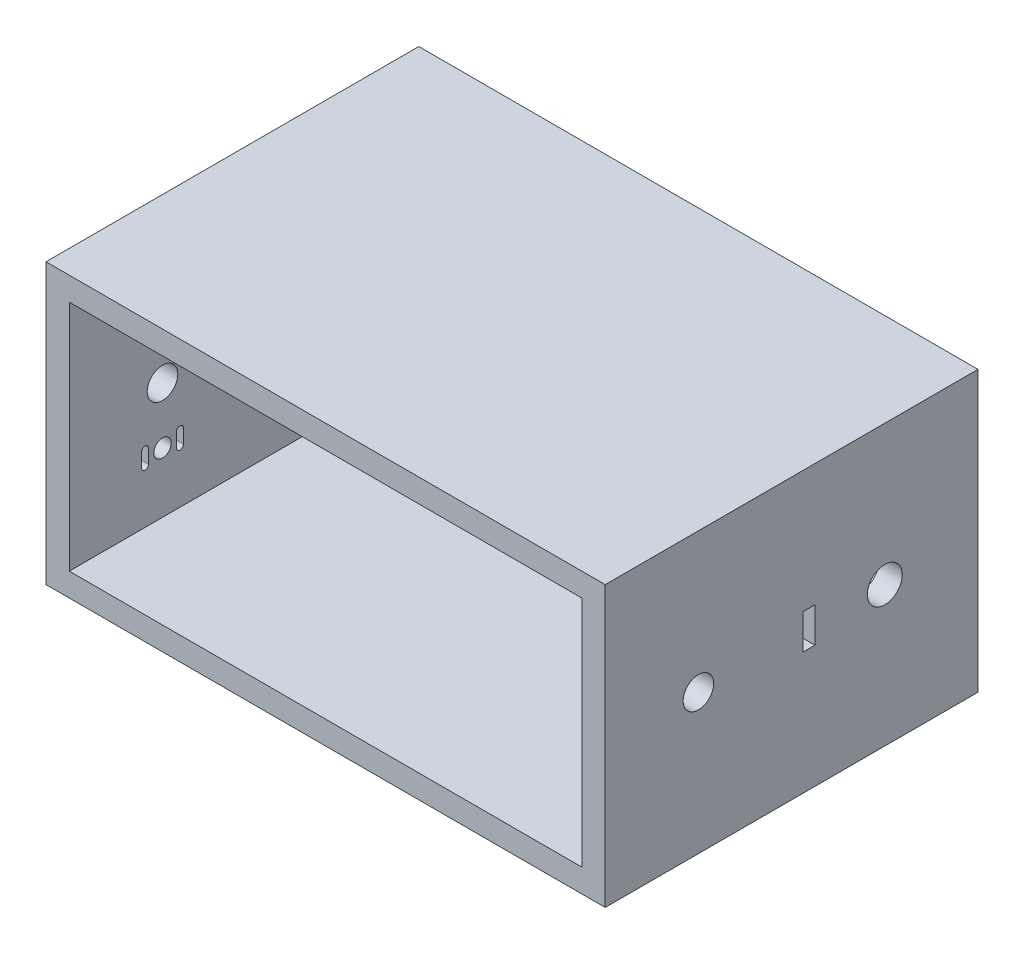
SolidWorks part; units mm, degrees
ref_plane "Front Plane" through (0, 0, 0) normal (0, 0, 1) x (1, 0, 0)
ref_plane "Top Plane" through (0, 0, 0) normal (0, 1, 0) x (1, 0, 0)
ref_plane "Right Plane" through (0, 0, 0) normal (1, 0, 0) x (0, 0, -1)
sketch "Sketch1" plane through (0, 0, 0) normal (0, 0, 1) x (1, 0, 0)
  line L1 (-36.7081, 125.987) -> (268.0919, 125.987)
  line L2 (-36.7081, 125.987) -> (-36.7081, -26.413)
  line L3 (-36.7081, -26.413) -> (268.0919, -26.413)
  line L4 (268.0919, 125.987) -> (268.0919, -26.413)
  line L5 (-24.0081, 113.287) -> (255.3919, 113.287)
  line L6 (-24.0081, 113.287) -> (-24.0081, -13.713)
  line L7 (-24.0081, -13.713) -> (255.3919, -13.713)
  line L8 (255.3919, 113.287) -> (255.3919, -13.713)
  dimension "D1" = 152.4
  dimension "D2" = 304.8
  dimension "D3" = 12.7
  dimension "D4" = 12.7
  dimension "D5" = 12.7
  dimension "D6" = 12.7
extrude "Boss-Extrude1" add sketch "Sketch1" along normal blind 203.2
hole_wizard "3/4-10 Tapped Hole1" positions "Sketch8" profile "Sketch10" tap size "3/4-10" standard "Ansi Inch"
sketch "Sketch8" plane through (268.0919, 0, 0) normal (1, 0, 0) x (0, 0, -1)
  line L1 (-203.2, 125.987) -> (0, 125.987) construction
  line L2 (-203.2, 125.987) -> (-203.2, -26.413) construction
  point P0 (-152.4, 49.787)
  dimension "D1" = 50.8
  dimension "D2" = 76.2
sketch "Sketch10" plane through (268.0919, 49.787, 152.4) normal (0, 1, 0) x (0, 0, -1)
  line L0 (0, 0) -> (0, 304.8)
  line L1 (0, 304.8) -> (8.3337, 304.8)
  line L2 (8.3337, 304.8) -> (8.3337, 0)
  line L5 (8.3337, 0) -> (0, 0)
  line L11 (0, -6.35) -> (0, 107.95) construction
  dimension "Thru Tap Drill Dia." = 16.6675
  dimension "Thru Tap Drill Depth" = 304.8
sketch "Sketch11" plane through (-36.7081, 0, 0) normal (-1, 0, 0) x (0, 0, 1)
  line L0 (161.925, 22.86) -> (161.925, 15.24) construction
  line L1 (203.2, 125.987) -> (203.2, -26.413) construction
  line L2 (142.875, 22.86) -> (142.875, 15.24) construction
  line L3 (144.78, 22.86) -> (144.78, 15.24)
  line L4 (140.97, 22.86) -> (140.97, 15.24)
  line L5 (152.4, 19.05) -> (152.4, 120.7899) construction
  line L6 (160.02, 22.86) -> (160.02, 15.24)
  line L7 (163.83, 22.86) -> (163.83, 15.24)
  circle A0 centre (152.4, 19.05) radius 4.7625
  arc A2 (144.78, 22.86) -> (140.97, 22.86) centre (142.875, 22.86) ccw
  arc A3 (140.97, 15.24) -> (144.78, 15.24) centre (142.875, 15.24) ccw
  arc A4 (160.02, 22.86) -> (163.83, 22.86) centre (161.925, 22.86) cw
  arc A5 (163.83, 15.24) -> (160.02, 15.24) centre (161.925, 15.24) cw
  point P8 (142.875, 19.05)
  point P13 (161.925, 19.05)
  dimension "D1" = 9.525
  dimension "D3" = 9.525
  dimension "D2" = 50.8
extrude "Cut-Extrude1" cut sketch "Sketch11" against normal up to next
sketch "Sketch15" plane through (-36.7081, 0, 0) normal (-1, 0, 0) x (0, 0, 1)
  line L0 (203.2, 125.987) -> (203.2, -26.413) construction
  line L1 (88.9, 40.262) -> (95.25, 40.262)
  line L2 (88.9, 40.262) -> (88.9, 59.312)
  line L3 (88.9, 59.312) -> (95.25, 59.312)
  line L4 (95.25, 40.262) -> (95.25, 59.312)
  line L5 (203.2, 125.987) -> (0, 125.987) construction
  dimension "D1" = 6.35
  dimension "D2" = 19.05
  dimension "D3" = 107.95
  dimension "D4" = 66.675
extrude "Cut-Extrude2" cut sketch "Sketch15" against normal through all
hole_wizard "#97 (0.0059) Diameter Hole3" positions "Sketch17" profile "Sketch16" hole size "#97" standard "Ansi Inch"
sketch "Sketch17" plane through (-36.7081, 0, 0) normal (-1, 0, 0) x (0, 0, 1)
  line L0 (203.2, 125.987) -> (0, 125.987) construction
  line L1 (88.9, 59.312) -> (88.9, 40.262) construction
  point P0 (50.8, 49.787)
  dimension "D1" = 76.2
  dimension "D2" = 38.1
sketch "Sketch16" plane through (-36.7081, 49.787, 50.8) normal (0, 1, 0) x (0, 0, 1)
  line L0 (0, 0) -> (0, 310.5232)
  line L1 (0, 310.5232) -> (9.525, 304.8)
  line L2 (9.525, 304.8) -> (9.525, 0)
  line L5 (9.525, 0) -> (0, 0)
  line L10 (0, 310.5232) -> (-9.525, 304.8) construction
  line L11 (0, -6.35) -> (0, 107.95) construction
  dimension "Hole Dia." = 19.05
  dimension "Hole Depth" = 304.8
  dimension "Drill Angle" = 118
